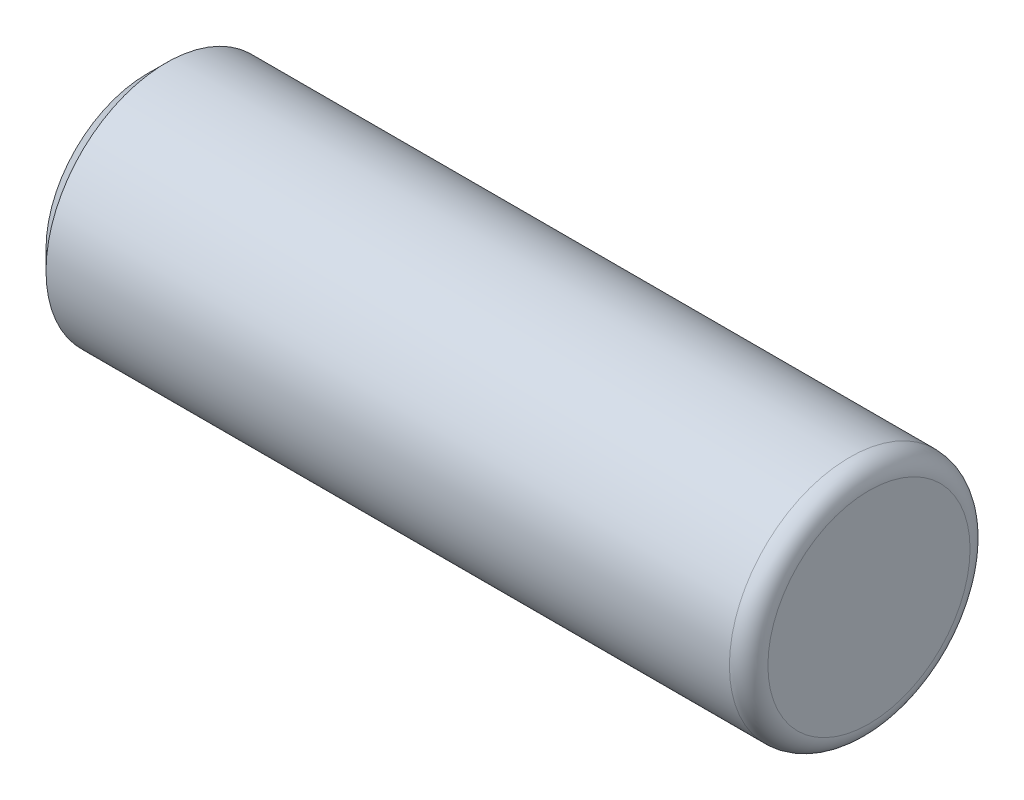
SolidWorks part; units mm, degrees
ref_plane "Front Plane" through (0, 0, 0) normal (0, 0, 1) x (1, 0, 0)
ref_plane "Top Plane" through (0, 0, 0) normal (0, 1, 0) x (1, 0, 0)
ref_plane "Right Plane" through (0, 0, 0) normal (1, 0, 0) x (0, 0, -1)
sketch "Sketch2" plane through (0, 0, 0) normal (0, 0, 1) x (1, 0, 0)
  line L0 (-14.1565, 0) -> (15.3613, 0) construction
  line L1 (-19.05, 0) -> (-19.05, 3.175)
  line L2 (-19.05, 3.175) -> (0, 3.175)
  line L3 (0, 3.175) -> (0, 0)
  line L4 (0, 0) -> (-19.05, 0)
  dimension "D1" = 6.35
  dimension "D2" = 19.05
revolve "Revolve1" add sketch "Sketch2" angle 360 about L0
chamfer "Chamfer1" distance 0.508 angle 45 1 edges at (-19.05, 0, 3.175)
fillet "Fillet1" radius 0.508 1 edges at (0, 0, 3.175)
